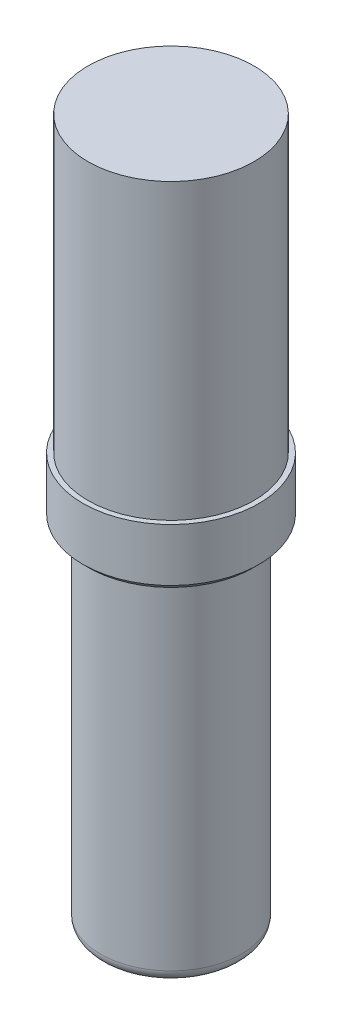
SolidWorks part; units mm, degrees
ref_plane "Top Plane" through (0, 0, 0) normal (0, 0, 1) x (1, 0, 0)
ref_plane "Front Plane" through (0, 0, 0) normal (0, 1, 0) x (1, 0, 0)
ref_plane "Right Plane" through (0, 0, 0) normal (1, 0, 0) x (0, 0, -1)
sketch "Sketch1" plane through (0, 0, 0) normal (0, 1, 0) x (1, 0, 0)
  line L1 (-5, -5) -> (5, -5) construction
  line L2 (-5, -5) -> (-5, 5) construction
  line L3 (-5, 5) -> (5, 5) construction
  line L4 (5, -5) -> (5, 5) construction
  line L5 (-5, -5) -> (5, 5) construction
  line L6 (-5, 5) -> (5, -5) construction
  circle A0 centre (0, 0) radius 7.0711
  dimension "D1" = 10
extrude "Boss-Extrude1" add sketch "Sketch1" along normal blind 25 contours A0
sketch "Sketch4" plane through (0, 0, 0) normal (0, -1, 0) x (1, 0, 0)
  circle A0 centre (0, 0) radius 7.5
  dimension "D1" = 15
extrude "Boss-Extrude3" add sketch "Sketch4" along normal blind 5
sketch "Sketch5" plane through (0, -5, 0) normal (0, -1, 0) x (-1, 0, 0)
  circle A0 centre (0, 0) radius 6
  dimension "D1" = 12
extrude "Boss-Extrude4" add sketch "Sketch5" along normal blind 30
fillet "Fillet4" radius 1 1 edges at (0, -35, -6)
chamfer "Chamfer5" distance 0.5 angle 45 1 edges at (0, -5, -7.5)
sketch "Sketch7" plane through (5, 0, 0) normal (1, 0, 0) x (0, 0, -1)
  line L0 (0, 25) -> (0, -0.5) construction
  line L1 (-5, 25) -> (5, 25) construction
  line L2 (-5, -0.5) -> (5, -0.5) construction
  circle A0 centre (0, 21) radius 2.5
  dimension "D2" = 5
  dimension "D1" = 4
extrude "Cut-Extrude2" cut sketch "Sketch7" against normal up to next
fillet "Fillet3" radius 1.5
chamfer "Chamfer2" distance 0.2 angle 45
chamfer "Chamfer3" distance 0.2 angle 45
